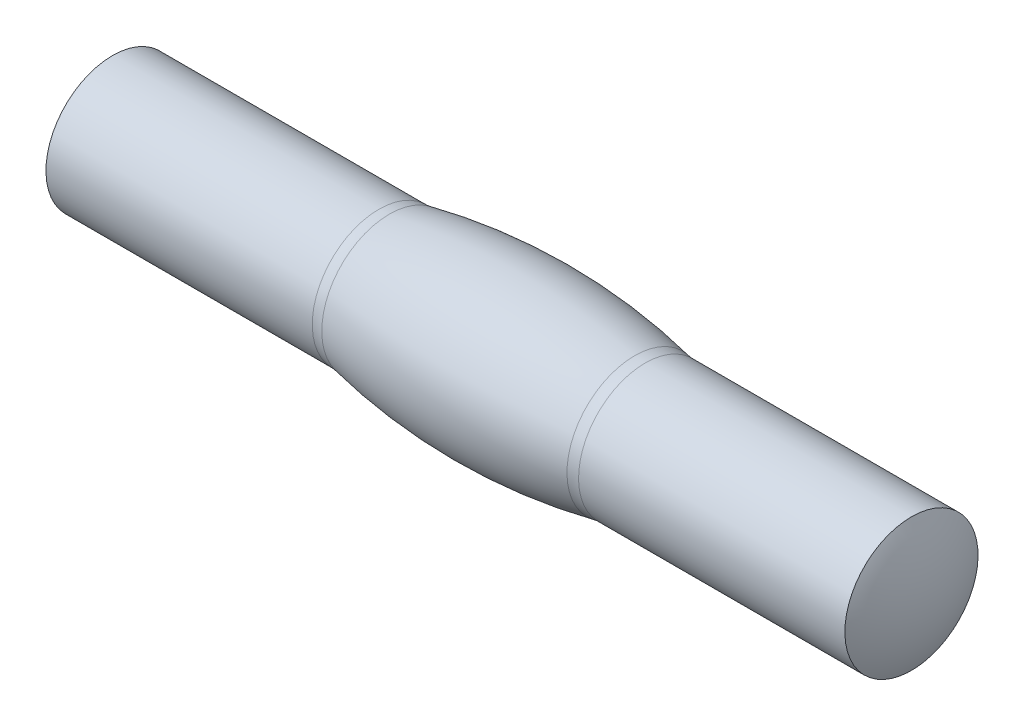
SolidWorks part; units mm, degrees
ref_plane "Face" through (0, 0, 0) normal (0, 0, 1) x (1, 0, 0)
ref_plane "Dessus" through (0, 0, 0) normal (0, 1, 0) x (1, 0, 0)
ref_plane "Droite" through (0, 0, 0) normal (1, 0, 0) x (0, 0, -1)
sketch "Esquisse1" plane through (0, 0, 0) normal (0, 0, 1) x (1, 0, 0)
  line L0 (46.6154, 0) -> (-46.6154, 0) construction
  line L1 (5, 2.5) -> (15, 2.5)
  line L2 (-5, 2.5) -> (-15, 2.5)
  line L3 (0, 0) -> (0, 30.6709) construction
  line L4 (15.6, 0) -> (-15.6, 0)
  arc A0 (5, 2.5) -> (4.604, 2.5396) centre (5, 4.5) cw
  arc A1 (4.604, 2.5396) -> (-4.604, 2.5396) centre (0, -20.25) ccw
  arc A2 (-4.604, 2.5396) -> (-5, 2.5) centre (-5, 4.5) cw
  arc A3 (15, 2.5) -> (15.6, 0) centre (10.0917, 0) cw
  arc A4 (-15, 2.5) -> (-15.6, 0) centre (-10.0917, 0) ccw
  dimension "D3" = 2
  dimension "D1" = 0.5
  dimension "D2" = 5
  dimension "D4" = 10
  dimension "D5" = 30
  dimension "D6" = 0.6
revolve "Révolution1" add sketch "Esquisse1" angle 360 about L0
